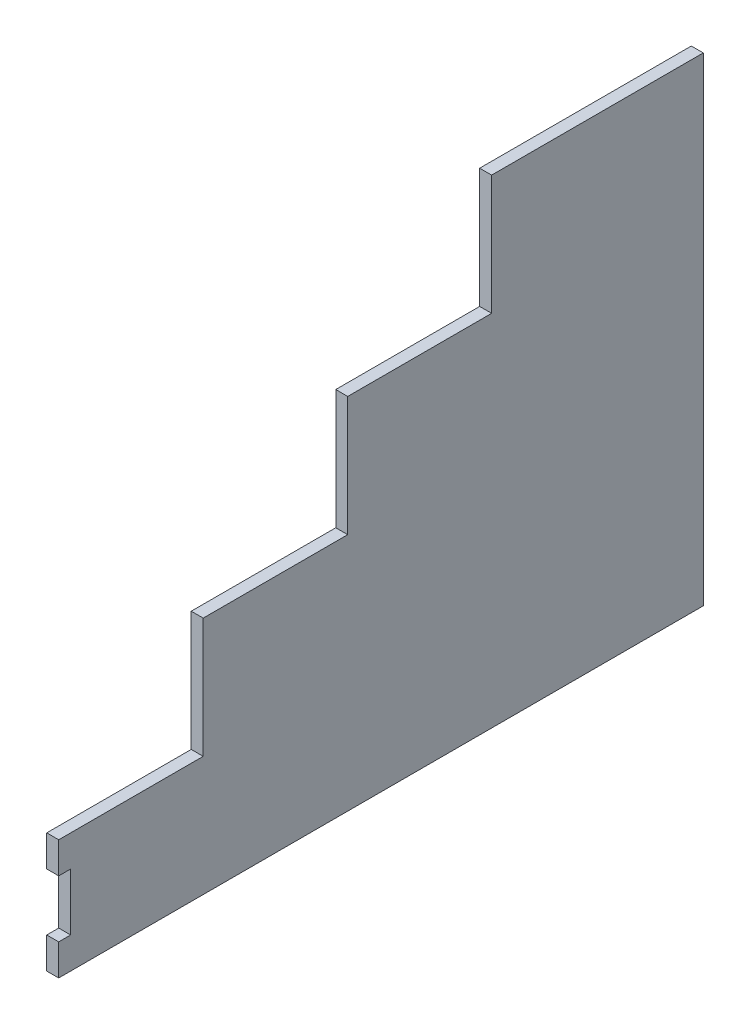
SolidWorks part; units mm, degrees
ref_plane "Front" through (0, 0, 0) normal (0, 0, 1) x (1, 0, 0)
ref_plane "Top" through (0, 0, 0) normal (0, 1, 0) x (1, 0, 0)
ref_plane "Right" through (0, 0, 0) normal (1, 0, 0) x (0, 0, -1)
sketch "Sketch2" plane through (0, 0, 0) normal (0, 1, 0) x (1, 0, 0)
  line L0 (0, 0) -> (0, -785.3759) construction
  line L1 (0, 0) -> (506.9879, -506.9879) construction
  line L2 (506.9879, -506.9879) -> (228.6, -785.3759) construction
  line L3 (228.6, -785.3759) -> (-228.6, -785.3759) construction
  line L4 (101.6, -478.7708) -> (290.1854, -290.1854) construction
  line L5 (165.1, -632.0733) -> (398.5867, -398.5867) construction
  line L6 (398.9058, -506.6688) -> (201.3401, -704.2345) construction
  line L7 (0, 0) -> (506.9879, -506.9879) construction
  line L8 (165.1, -632.0733) -> (-165.1, -632.0733) construction
  line L9 (344.7051, -452.4682) -> (453.1064, -560.8695) construction
  line L10 (101.6, -478.7708) -> (-101.6, -478.7708) construction
  line L11 (182.4223, -182.4223) -> (38.7382, -326.1064) construction
  line L12 (38.7382, -326.1064) -> (-38.7382, -326.1064) construction
  line L13 (344.7051, -452.4682) -> (236.3038, -344.0669) construction
  line L14 (236.3038, -344.0669) -> (128.5408, -236.3038) construction
  line L15 (290.5045, -398.2676) -> (191.7217, -497.0504) construction
  line L16 (182.4223, -290.1854) -> (74.6592, -397.9485) construction
  line L17 (74.6592, -397.9485) -> (-74.6592, -397.9485) construction
  line L18 (128.5408, -236.3038) -> (74.6592, -182.4223) construction
  line L19 (74.6592, -709.1759) -> (74.6592, -555.8733) construction
  line L20 (74.6592, -397.9485) -> (74.6592, -555.8733) construction
  line L21 (74.6592, -397.9485) -> (74.6592, -182.4223) construction
  line L22 (300.1229, -605.4517) -> (191.7217, -497.0504) construction
  line L23 (101.6, -101.6) -> (-101.6, -101.6) construction
  line L24 (0, 0) -> (-506.9879, -506.9879) construction
  line L25 (0, 0) -> (-506.9879, -506.9879) construction
  line L26 (-300.1229, -605.4517) -> (-191.7217, -497.0504) construction
  line L27 (-74.6592, -397.9485) -> (-74.6592, -182.4223) construction
  line L28 (-74.6592, -397.9485) -> (-74.6592, -555.8733) construction
  line L29 (-74.6592, -709.1759) -> (-74.6592, -555.8733) construction
  line L30 (-128.5408, -236.3038) -> (-74.6592, -182.4223) construction
  line L31 (-182.4223, -290.1854) -> (-74.6592, -397.9485) construction
  line L32 (-290.5045, -398.2676) -> (-191.7217, -497.0504) construction
  line L33 (-236.3038, -344.0669) -> (-128.5408, -236.3038) construction
  line L34 (-344.7051, -452.4682) -> (-236.3038, -344.0669) construction
  line L35 (-182.4223, -182.4223) -> (-38.7382, -326.1064) construction
  line L36 (-344.7051, -452.4682) -> (-453.1064, -560.8695) construction
  line L37 (-398.9058, -506.6688) -> (-201.3401, -704.2345) construction
  line L38 (-165.1, -632.0733) -> (-398.5867, -398.5867) construction
  line L39 (-101.6, -478.7708) -> (-290.1854, -290.1854) construction
  line L40 (-506.9879, -506.9879) -> (-228.6, -785.3759) construction
  circle A0 centre (398.9058, -506.6688) radius 50.8 construction
  circle A1 centre (300.1229, -605.4517) radius 50.8 construction
  circle A2 centre (201.3401, -704.2345) radius 50.8 construction
  circle A3 centre (290.5045, -398.2676) radius 50.8 construction
  circle A4 centre (74.6592, -182.4223) radius 50.8 construction
  circle A5 centre (74.6592, -555.8733) radius 50.8 construction
  circle A6 centre (182.4223, -290.1854) radius 50.8 construction
  circle A7 centre (191.7217, -497.0504) radius 50.8 construction
  circle A8 centre (74.6592, -397.9485) radius 50.8 construction
  circle A9 centre (74.6592, -709.1759) radius 50.8 construction
  circle A10 centre (-74.6592, -709.1759) radius 50.8 construction
  circle A11 centre (-74.6592, -397.9485) radius 50.8 construction
  circle A12 centre (-191.7217, -497.0504) radius 50.8 construction
  circle A13 centre (-182.4223, -290.1854) radius 50.8 construction
  circle A14 centre (-74.6592, -555.8733) radius 50.8 construction
  circle A15 centre (-74.6592, -182.4223) radius 50.8 construction
  circle A16 centre (-290.5045, -398.2676) radius 50.8 construction
  circle A17 centre (-201.3401, -704.2345) radius 50.8 construction
  circle A18 centre (-300.1229, -605.4517) radius 50.8 construction
  circle A19 centre (-398.9058, -506.6688) radius 50.8 construction
  point P40 (0, 0)
  point P42 (0, 0)
  point P44 (0, -101.6)
  point P66 (0, -397.9485)
  point P69 (0, -326.1064)
  point P71 (0, -478.7708)
  point P73 (0, -632.0733)
  dimension "D16" = 101.6
  dimension "D1" = 76.2
  dimension "D2" = 76.2
  dimension "D3" = 228.6
  dimension "D4" = 101.6
  dimension "D5" = 114.3
  dimension "D6" = 139.7
  dimension "D7" = 76.2
  dimension "D8" = 76.2
  dimension "D9" = 393.7
  dimension "D10" = 165.1
  dimension "D11" = 101.6
  dimension "D12" = 330.2
  dimension "D13" = 266.7
  dimension "D14" = 203.2
  dimension "D15" = 45
sketch "Sketch3" plane through (0, 0, 0) normal (1, 0, 0) x (0, 0, -1)
  line L0 (-101.6, 0) -> (-101.6, 508)
  line L1 (-101.6, 508) -> (-326.1064, 508)
  line L2 (-326.1064, 508) -> (-326.1064, 381)
  line L3 (-326.1064, 381) -> (-478.7708, 381)
  line L4 (-478.7708, 381) -> (-478.7708, 254)
  line L5 (-478.7708, 254) -> (-632.0733, 254)
  line L6 (-632.0733, 254) -> (-632.0733, 127)
  line L7 (-632.0733, 127) -> (-785.3759, 127)
  line L8 (-785.3759, 127) -> (-785.3759, 93.8095)
  line L9 (-101.6, 0) -> (-785.3759, 0)
  line L10 (-785.3759, 93.8095) -> (-772.6759, 93.8095)
  line L11 (-772.6759, 93.8095) -> (-772.6759, 33.1905)
  line L12 (-772.6759, 33.1905) -> (-785.3759, 33.1905)
  line L13 (-785.3759, 33.1905) -> (-785.3759, 0)
  line L14 (-506.9879, 0) -> (-785.3759, 0) construction
  line L15 (0, 0) -> (-785.3759, 0) construction
  dimension "D1" = 127
  dimension "D2" = 33.1905
  dimension "D3" = 12.7
  dimension "D4" = 127
extrude "Extrude1" add sketch "Sketch3" along normal mid plane 12.7
